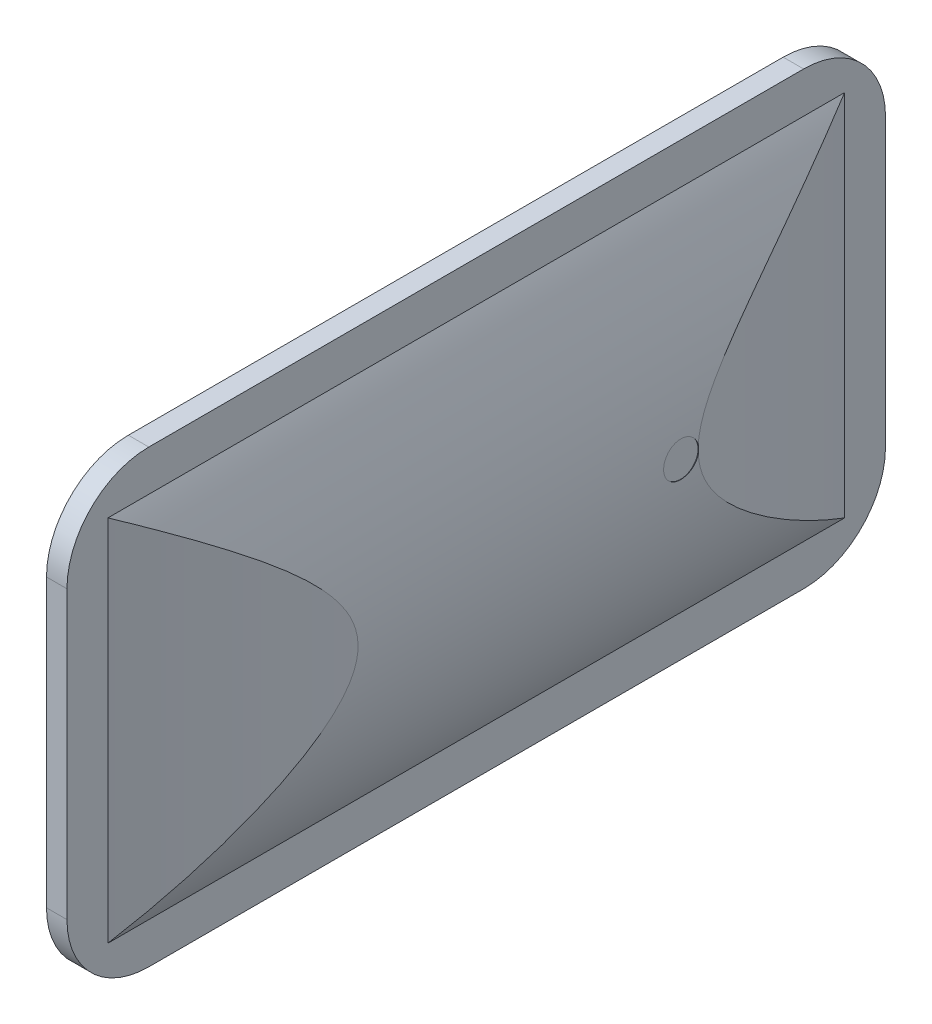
SolidWorks part; units mm, degrees
ref_plane "Plane1" through (0, 0, 0) normal (0, 0, 1) x (1, 0, 0)
ref_plane "Plane2" through (0, 0, 0) normal (0, 1, 0) x (1, 0, 0)
ref_plane "Plane3" through (0, 0, 0) normal (1, 0, 0) x (0, 0, -1)
sketch "Sketch1" plane through (0, 0, 0) normal (0, 0, 1) x (1, 0, 0)
  line L0 (0, 139.7) -> (0, 0) construction
  line L1 (-3.175, 0) -> (-3.175, 12.7)
  line L2 (-3.175, 139.7) -> (3.175, 139.7)
  line L3 (-3.175, 139.7) -> (-3.175, 127)
  line L4 (3.175, 139.7) -> (3.175, 127)
  line L5 (-3.175, 0) -> (3.175, 0)
  line L8 (3.175, 0) -> (3.175, 12.7)
  arc A0 (3.175, 127) -> (3.175, 12.7) centre (-90.1805, 69.85) cw
  arc A1 (-3.175, 127) -> (-3.175, 12.7) centre (90.1805, 69.85) ccw
extrude "Base-Extrude" add sketch "Sketch1" along normal blind 254
sketch "Sketch2" plane through (0, 139.7, 0) normal (0, 1, 0) x (-1, 0, 0)
  line L0 (3.175, 0) -> (-3.175, 0)
  line L1 (-3.175, 0) -> (-3.175, 12.7)
  line L2 (-3.175, 254) -> (-3.175, 0) construction
  line L3 (-3.175, 254) -> (3.175, 254)
  line L4 (-3.175, 254) -> (3.175, 254) construction
  line L5 (-3.175, 254) -> (-3.175, 241.3)
  line L6 (0, 0) -> (0, 254) construction
  line L7 (3.175, 254) -> (3.175, 241.3)
  line L8 (3.175, 0) -> (3.175, 12.7)
  arc A0 (-3.175, 241.3) -> (-3.175, 12.7) centre (307.9518, 127) ccw
  arc A1 (3.175, 241.3) -> (3.175, 12.7) centre (-307.9518, 127) cw
  dimension "D1" = 12.7
  dimension "D2" = 12.7
extrude "Cut-Extrude1" cut sketch "Sketch2" against normal through all flip side to cut
sketch "Sketch3" plane through (3.175, 0, 0) normal (1, 0, 0) x (0, 0, -1)
  line L0 (0, 0) -> (0, 139.7) construction
  line L2 (-307.0721, 69.85) -> (-147.8557, 69.85) construction
  circle A0 centre (-79.4972, 69.85) radius 5.461
  dimension "D2" = 10.922
  dimension "D1" = 79.4972
extrude "Cut-Extrude2" cut sketch "Sketch3" along normal up to next
fillet "Fillet1" radius 25.4 4 edges at (0, 0, 254) (0, 139.7, 254) (0, 0, 0) (0, 139.7, 0)
sketch "Sketch4" plane through (0, 0, 0) normal (1, 0, 0) x (0, 0, -1)
  circle A0 centre (-79.4972, 69.85) radius 5.461
  dimension "D1" = 10.922
extrude "Boss-Extrude1" add sketch "Sketch4" along normal blind 19.05
